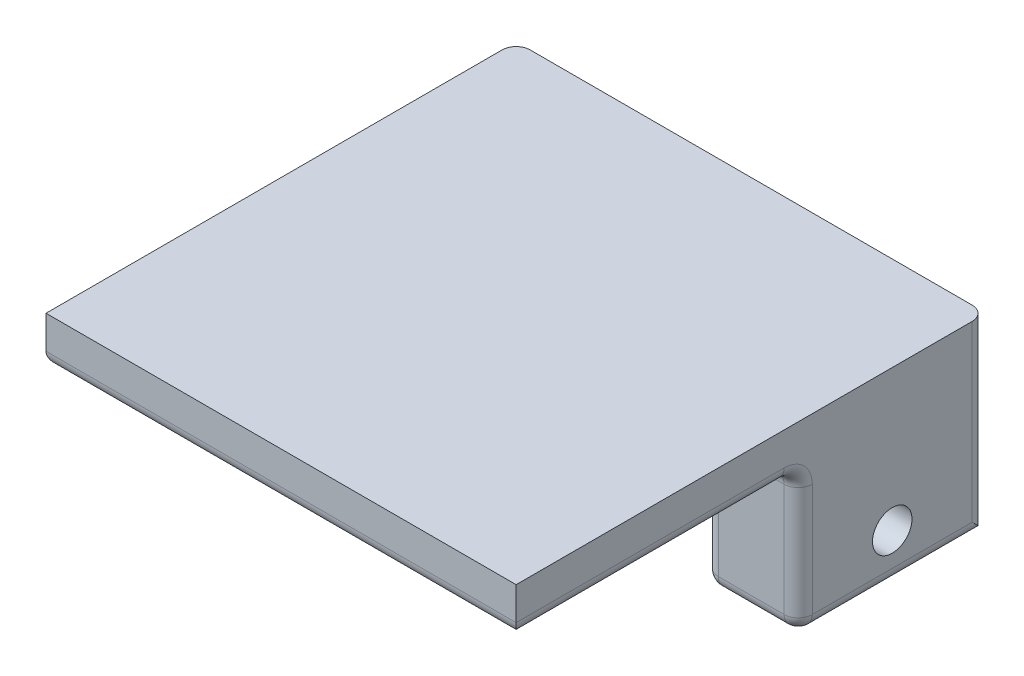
SolidWorks part; units mm, degrees
ref_plane "Front Plane" through (0, 0, 0) normal (0, 0, 1) x (1, 0, 0)
ref_plane "Top Plane" through (0, 0, 0) normal (0, 1, 0) x (1, 0, 0)
ref_plane "Right Plane" through (0, 0, 0) normal (1, 0, 0) x (0, 0, -1)
sketch "Sketch1" plane through (0, 0, 0) normal (0, 1, 0) x (1, 0, 0)
  line L1 (-25, 25) -> (25, 25)
  line L2 (-25, 25) -> (-25, -25)
  line L3 (-25, -25) -> (25, -25)
  line L4 (25, 25) -> (25, -25)
  line L5 (-25, 25) -> (25, -25) construction
  line L6 (-25, -25) -> (25, 25) construction
  point P0 (0, 0)
  dimension "D1" = 50
  dimension "D2" = 50
extrude "Boss-Extrude1" add sketch "Sketch1" along normal blind 5
sketch "Sketch3" plane through (0, 0, 0) normal (0, -1, 0) x (1, 0, 0)
  line L0 (-25, -25) -> (-25, 25) construction
  line L1 (-25, -5) -> (-15, -5)
  line L2 (-25, -5) -> (-25, -25)
  line L3 (-25, -25) -> (-15, -25)
  line L4 (-15, -5) -> (-15, -25)
  line L5 (25, -25) -> (-25, -25) construction
  line L6 (0, 0) -> (0, -21.3389) construction
  line L7 (25, -25) -> (15, -25)
  line L8 (15, -5) -> (15, -25)
  line L9 (25, -5) -> (15, -5)
  line L10 (25, -5) -> (25, -25)
  dimension "D1" = 20
  dimension "D2" = 10
extrude "Boss-Extrude2" add sketch "Sketch3" along normal blind 15
sketch "Sketch4" plane through (25, 0, 0) normal (1, 0, 0) x (0, 0, -1)
  line L0 (0, 0) -> (20, 0) construction
  line L1 (5, -15) -> (25, -15) construction
  line L2 (2.4903, 0) -> (19.4002, 0) construction
  line L3 (15, -5) -> (15, -15) construction
  line L4 (5, -15) -> (5, 0) construction
  circle A1 centre (15, -10) radius 2.1
  dimension "D3" = 4.2
  dimension "D1" = 10
  dimension "D2" = 10
extrude "Cut-Extrude2" cut sketch "Sketch4" against normal through all both and the other way through all
sketch "Sketch6" plane through (25, 0, 0) normal (1, 0, 0) x (0, 0, -1)
  line L1 (22.5, 6.8116) -> (22.5, -12.977) construction
sketch "Sketch7" plane through (0, 0, 0) normal (0, 1, 0) x (1, 0, 0)
  line L0 (-0.5, 25) -> (0.5, 25)
  line L1 (0, 19.8578) -> (0, -28.2136) construction
  line L5 (0.5, 25) -> (0.5, -25)
  line L6 (-25, -25) -> (25, -25) construction
  line L7 (0.5, -25) -> (-0.5, -25)
  line L8 (-0.5, -25) -> (-0.5, 25)
  line L9 (25, 25) -> (-25, 25) construction
extrude "Cut-Extrude4" cut sketch "Sketch7" along normal blind 0.5
fillet "Fillet5" radius 1.5 23 edges at (-25, -5, -25) (-15, -15, -15) (15, -7.5, -25) (-15, -7.5, -25) (25, -5, -25) (25, -15, -15) (25, -7.5, -5) (25, 0, 10) (-25, 0, 10) (-25, -7.5, -5) (15, 0, -15) (-20, -15, -5) (-15, -7.5, -5) (15, -15, -15) (20, -15, -5) (15, -7.5, -5) (20, 0, -5) (-20, 0, -5) (-15, 0, -15) (-7.75, 0, -25) (7.75, 0, -25) (12.75, 0, 25) (-25, -15, -15)
